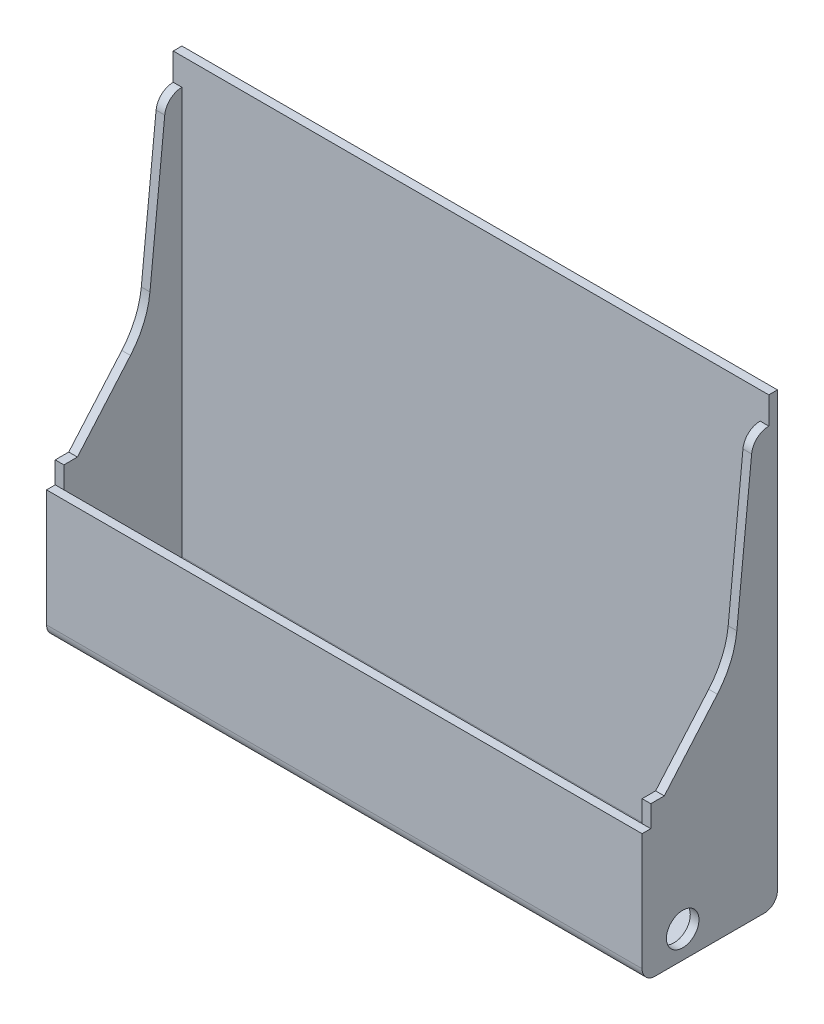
SolidWorks part; units mm, degrees
ref_plane "Front" through (0, 0, 0) normal (0, 0, 1) x (1, 0, 0)
ref_plane "Top" through (0, 0, 0) normal (0, 1, 0) x (1, 0, 0)
ref_plane "Right" through (0, 0, 0) normal (1, 0, 0) x (0, 0, -1)
sketch "Sketch1" plane through (0, 0, 0) normal (0, 0, 1) x (1, 0, 0)
  line L1 (-34.925, 0) -> (34.925, 0)
  line L2 (-34.925, 0) -> (-34.925, 52.3875)
  line L3 (-34.925, 52.3875) -> (34.925, 52.3875)
  line L4 (34.925, 0) -> (34.925, 52.3875)
  dimension "D1" = 69.85
  dimension "D2" = 52.3875
extrude "Extrude1" add sketch "Sketch1" along normal blind 15.875
fillet "Fillet1" radius 1.524
shell "Shell1" thickness 1.016
sketch "Sketch2" plane through (34.925, 0, 0) normal (1, 0, 0) x (0, 0, -1)
  line L0 (-1.016, 1.524) -> (-1.016, 52.3875) construction
  line L2 (-3.0288, 47.3934) -> (-4.7625, 30.2944)
  line L3 (-7.0468, 24.9897) -> (-13.2715, 17.78)
  line L4 (-13.2715, 17.78) -> (-14.859, 17.78)
  line L5 (-14.859, 17.78) -> (-14.859, 15.24)
  line L6 (-14.859, 15.24) -> (-15.875, 15.24)
  line L7 (-15.875, 1.524) -> (-15.875, 52.3875) construction
  line L9 (-14.859, 1.524) -> (-14.859, 52.3875) construction
  line L10 (-14.351, 0) -> (-1.524, 0) construction
  line L11 (-1.016, 49.2125) -> (1.1859, 49.2125) construction
  line L12 (-15.875, 52.3875) -> (0, 52.3875) construction
  line L13 (0, 1.524) -> (0, 52.3875) construction
  line L14 (-1.016, 49.2125) -> (-1.016, 52.3875)
  line L15 (-1.016, 52.3875) -> (-15.875, 52.3875)
  line L16 (-15.875, 52.3875) -> (-15.875, 15.24)
  arc A0 (-1.016, 49.2125) -> (-3.0288, 47.3934) centre (-1.016, 47.1894) ccw
  arc A1 (-4.7625, 30.2944) -> (-7.0468, 24.9897) centre (-14.3125, 31.2626) cw
  dimension "D5" = 9.5989
  dimension "D6" = 2.0231
  dimension "D1" = 15.24
  dimension "D2" = 2.54
  dimension "D3" = 1.5875
  dimension "D4" = 9.525
  dimension "D7" = 3.175
  dimension "D8" = 4.7625
extrude "Cut-Extrude1" cut sketch "Sketch2" against normal through all
sketch "Sketch3" plane through (34.925, 0, 0) normal (1, 0, 0) x (0, 0, -1)
  line L0 (-15.875, 1.524) -> (-15.875, 15.24) construction
  line L1 (-14.351, 0) -> (-1.524, 0) construction
  circle A0 centre (-11.1125, 3.175) radius 1.905
  dimension "D1" = 3.81
  dimension "D2" = 4.7625
  dimension "D3" = 3.175
extrude "Cut-Extrude2" cut sketch "Sketch3" against normal through all
